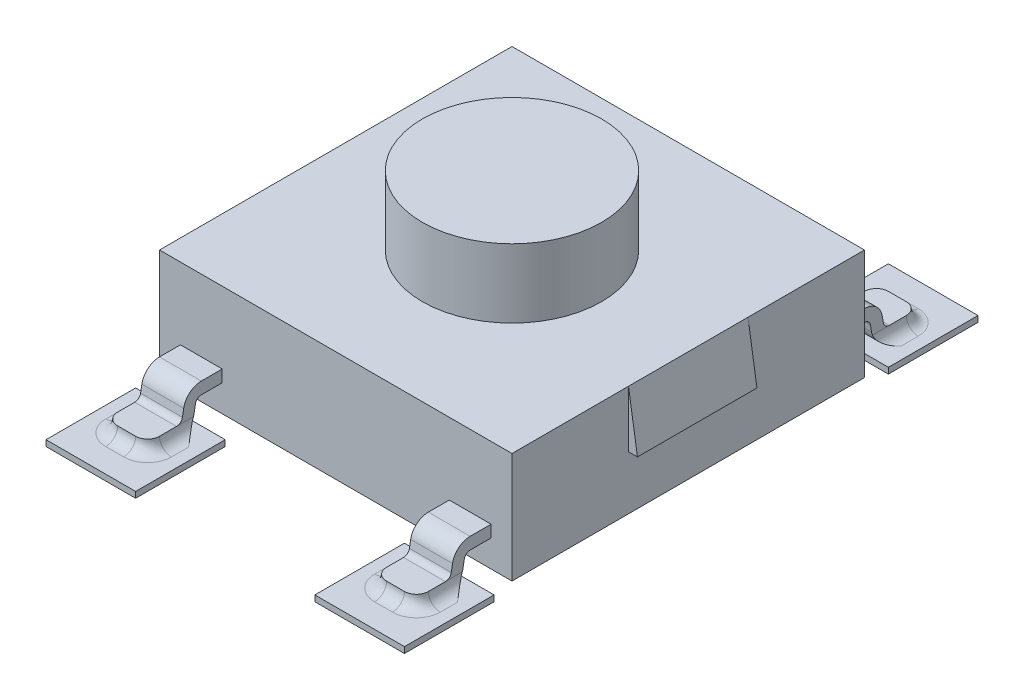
SolidWorks part; units mm, degrees
ref_plane "Front Plane" through (0, 0, 0) normal (0, 0, 1) x (1, 0, 0)
ref_plane "Top Plane" through (0, 0, 0) normal (0, 1, 0) x (1, 0, 0)
ref_plane "Right Plane" through (0, 0, 0) normal (1, 0, 0) x (0, 0, -1)
sketch "Sketch1" plane through (0, 0, 0) normal (0, 1, 0) x (1, 0, 0)
  line L0 (0, -55) -> (0, 55) construction
  line L1 (2.95, -2.95) -> (-2.95, -2.95)
  line L2 (2.95, -2.95) -> (2.95, 2.95)
  line L3 (2.95, 2.95) -> (-2.95, 2.95)
  line L4 (-2.95, -2.95) -> (-2.95, 2.95)
  line L5 (-55, 0) -> (55, 0) construction
  dimension "D1" = 5.9
  dimension "D2" = 2.95
  dimension "D3" = 2.95
extrude "Boss-Extrude1" add sketch "Sketch1" along normal blind 1.85
sketch "Sketch2" plane through (0, 0, 0) normal (0, 0, 1) x (1, 0, 0)
  line L0 (-2.95, 1.85) -> (-3.1, 0.9)
  line L1 (-3.1, 0.9) -> (3.1, 0.9)
  line L2 (3.1, 0.9) -> (2.95, 1.85)
  line L3 (2.95, 1.85) -> (-2.95, 1.85)
  line L4 (0, -1.0175) -> (0, 1.0175) construction
  dimension "D1" = 0.95
  dimension "D2" = 6.2
  dimension "D3" = 3.1
extrude "Boss-Extrude2" add sketch "Sketch2" along normal mid plane 2
ref_plane "Plane1" through (2.25, 0, 0) normal (1, 0, 0) x (0, 0, -1)
sketch "Sketch3" plane through (2.25, 0, 0) normal (1, 0, 0) x (0, 0, -1)
  line L0 (-4.2, 0.1) -> (-3.715, 0.1)
  line L1 (-3.518, 0.2653) -> (-3.497, 0.3847)
  line L2 (-3.3, 0.55) -> (3.3, 0.55)
  line L3 (3.497, 0.3847) -> (3.518, 0.2653)
  line L4 (3.715, 0.1) -> (4.2, 0.1)
  line L5 (3.245, 0) -> (-3.245, 0) construction
  line L6 (0, 1.0175) -> (0, -1.0175) construction
  arc A0 (3.3, 0.55) -> (3.497, 0.3847) centre (3.3, 0.35) cw
  arc A1 (3.518, 0.2653) -> (3.715, 0.1) centre (3.715, 0.3) ccw
  arc A2 (-3.715, 0.1) -> (-3.518, 0.2653) centre (-3.715, 0.3) ccw
  arc A3 (-3.497, 0.3847) -> (-3.3, 0.55) centre (-3.3, 0.35) cw
  dimension "D6" = 0.2
  dimension "D7" = 0.2
  dimension "D1" = 0.1
  dimension "D2" = 0.55
  dimension "D3" = 10
  dimension "D4" = 10
  dimension "D5" = 4.2
  dimension "D8" = 3.3
  dimension "D9" = 3.3
extrude "Extrude-Thin1" add sketch "Sketch3" along normal mid plane 0.7 thin
fillet "Fillet1" radius 0.2 4 edges at (1.9, 0.1, -4.2) (2.6, 0.1, -4.2) (1.9, 0.1, 4.2) (2.6, 0.1, 4.2)
pattern_linear "LPattern1" count 2 spacing 4.5 along (-1, 0, 0) of "Fillet1", "Extrude-Thin1"
sketch "Sketch4" plane through (0, 0, 0) normal (0, 1, 0) x (1, 0, 0)
  line L0 (0, -1.0175) -> (0, 1.0175) construction
  line L1 (-3, 4.8) -> (-1.5, 4.8)
  line L2 (-3, 4.8) -> (-3, 3.3)
  line L3 (-3, 3.3) -> (-1.5, 3.3)
  line L4 (-1.5, 4.8) -> (-1.5, 3.3)
  line L5 (1.5, 4.8) -> (3, 4.8)
  line L6 (1.5, 4.8) -> (1.5, 3.3)
  line L7 (1.5, 3.3) -> (3, 3.3)
  line L8 (3, 4.8) -> (3, 3.3)
  line L9 (1.5, -3.3) -> (3, -3.3)
  line L10 (1.5, -3.3) -> (1.5, -4.8)
  line L11 (1.5, -4.8) -> (3, -4.8)
  line L12 (3, -3.3) -> (3, -4.8)
  line L13 (-3, -3.3) -> (-1.5, -3.3)
  line L14 (-3, -3.3) -> (-3, -4.8)
  line L15 (-3, -4.8) -> (-1.5, -4.8)
  line L16 (-1.5, -3.3) -> (-1.5, -4.8)
  line L17 (-0.75, 4.8) -> (0.75, 4.8)
  line L18 (-0.75, 4.8) -> (-0.75, 3.3)
  line L19 (-0.75, 3.3) -> (0.75, 3.3)
  line L20 (0.75, 4.8) -> (0.75, 3.3)
  line L21 (-1.0175, 0) -> (1.0175, 0) construction
  dimension "D1" = 1.5
  dimension "D2" = 4.5
  dimension "D3" = 1.5
  dimension "D4" = 0.75
  dimension "D5" = 3.3
  dimension "D6" = 3.3
extrude "Boss-Extrude3" add sketch "Sketch4" against normal blind 0.1
fillet "Fillet2" radius 0.2 20 edges at (1.9, 0, -3.8575) (2.6, 0, -3.8575) (2.5414, 0, -4.1414) (2.25, 0, -4.2) (-1.9, 0, -3.8575) (-1.9586, 0, -4.1414) (-2.25, 0, -4.2) (-2.5414, 0, -4.1414) (2.6, 0, 3.8575) (2.5414, 0, 4.1414) (1.9, 0, 3.8575) (1.9586, 0, 4.1414) (-1.9, 0, 3.8575) (-1.9586, 0, 4.1414) (-2.25, 0, 4.2) (-2.6, 0, 3.8575) (1.9586, 0, -4.1414) (-2.6, 0, -3.8575) (2.25, 0, 4.2) (-2.5414, 0, 4.1414)
sketch "Sketch5" plane through (0, 1.85, 0) normal (0, 1, 0) x (1, 0, 0)
  circle A0 centre (0, 0) radius 1.5
  dimension "D1" = 3
extrude "Boss-Extrude4" add sketch "Sketch5" along normal blind 1.15
